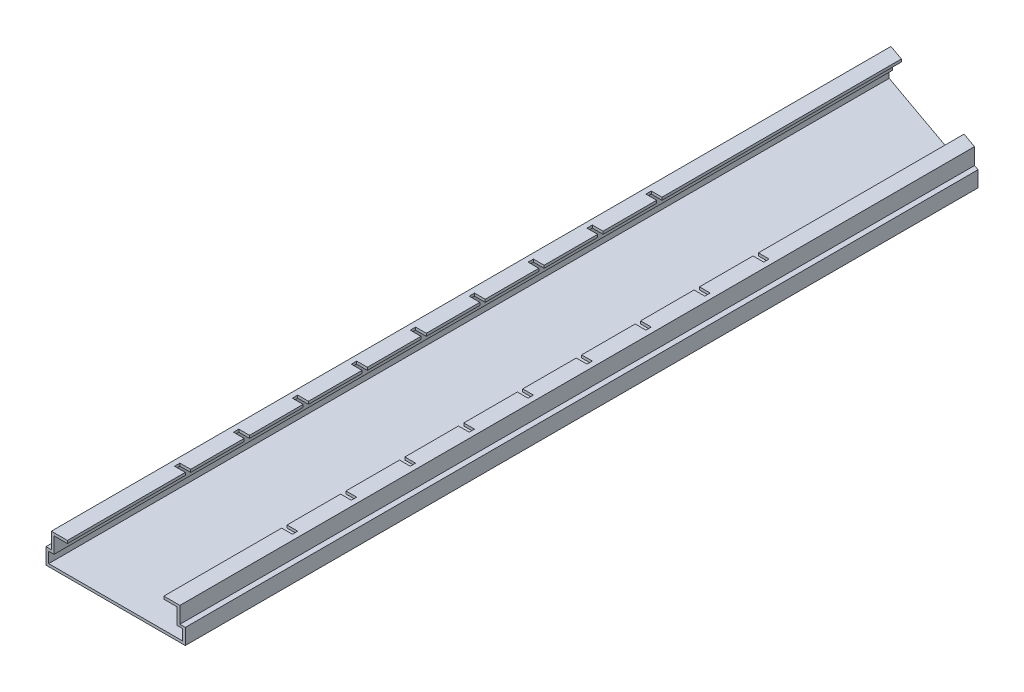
SolidWorks part; units mm, degrees
ref_plane "Plan de face" through (0, 0, 0) normal (0, 0, 1) x (1, 0, 0)
ref_plane "Plan de dessus" through (0, 0, 0) normal (0, 1, 0) x (1, 0, 0)
ref_plane "Plan de droite" through (0, 0, 0) normal (1, 0, 0) x (0, 0, -1)
sketch "Esquisse1" plane through (0, 0, 0) normal (0, 1, 0) x (1, 0, 0)
  line L0 (-13, 145) -> (-13, 157.1)
  line L1 (-13, 0) -> (13, 0)
  line L2 (-13, 0) -> (-13, 145)
  line L3 (-13, 145) -> (13, 145)
  line L4 (13, 0) -> (13, 145)
  line L5 (-13, 157.1) -> (13, 148)
  line L6 (13, 148) -> (13, 145)
  dimension "D1" = 26
  dimension "D2" = 145
  dimension "D3" = 3
  dimension "D4" = 12.1
extrude "Boss.-Extru.1" add sketch "Esquisse1" along normal blind 0.5
sketch "Esquisse3" plane through (0, 0, 0) normal (0, 0, 1) x (1, 0, 0)
  line L0 (-12, 6) -> (-12, 3)
  line L1 (-12, 6) -> (12, 6)
  line L2 (12, 6) -> (12, 2.9394)
  line L3 (-12, 3) -> (-13, 3)
  line L4 (-13, 0) -> (13, 0)
  line L5 (13, 0) -> (13, 0.5)
  line L6 (-13, 0) -> (13, 0)
  line L7 (-13, 0.5) -> (-13, 0)
  line L8 (13, 0.5) -> (-13, 0.5)
  line L9 (13, 0) -> (13, 0.5)
  line L10 (13, 0.5) -> (-13, 0.5)
  line L11 (-13, 0.5) -> (-13, 0)
  line L12 (-13, 3) -> (-13, 0.5)
  line L13 (12, 2.9394) -> (13, 2.9394)
  line L14 (13, 2.9394) -> (13, 0.5)
  line L15 (-9, 6) -> (-9, 5.5)
  line L16 (-9, 5.5) -> (-11.5, 5.5)
  line L17 (-11.5, 5.5) -> (-11.5, 2.5)
  line L18 (-11.5, 2.5) -> (-12.5, 2.5)
  line L19 (-12.5, 2.5) -> (-12.5, 0.5)
  line L20 (11.5, 2.5) -> (12.5, 2.5)
  line L21 (0, 0) -> (0, 9.4792) construction
  line L22 (12.5, 2.5) -> (12.5, 0.5)
  line L23 (13, 3) -> (13, 0.5)
  line L24 (12, 3) -> (13, 3)
  line L25 (11.5, 5.5) -> (11.5, 2.5)
  line L26 (12, 6) -> (12, 3)
  line L27 (9, 6) -> (9, 5.5)
  line L28 (9, 5.5) -> (11.5, 5.5)
  point P6 (0, 6)
  dimension "D2" = 24
  dimension "D3" = 5.5
  dimension "D4" = 0.5
  dimension "D5" = 0.5
  dimension "D6" = 0.5
  dimension "D7" = 0.5
  dimension "D10" = 3
  dimension "D1" = 0
extrude "Boss.-Extru.2" add sketch "Esquisse3" against normal up to surface (149.4 mm away) contours L27 L28 L25 L20 L22 L14 L13 L2 L1 M36
sketch "Esquisse5" plane through (0, 0, 0) normal (0, 0, 1) x (1, 0, 0)
  line L0 (-12, 6) -> (-12, 3)
  line L1 (-12, 6) -> (12, 6)
  line L2 (12, 6) -> (12, 2.9394)
  line L3 (-12, 3) -> (-13, 3)
  line L6 (-13, 0) -> (13, 0)
  line L9 (13, 0) -> (13, 0.5)
  line L10 (13, 0.5) -> (-13, 0.5)
  line L11 (-13, 0.5) -> (-13, 0)
  line L12 (-13, 3) -> (-13, 0.5)
  line L13 (12, 2.9394) -> (13, 2.9394)
  line L14 (13, 2.9394) -> (13, 0.5)
  line L15 (-9, 6) -> (-9, 5.5)
  line L16 (-9, 5.5) -> (-11.5, 5.5)
  line L17 (-11.5, 5.5) -> (-11.5, 2.5)
  line L18 (-11.5, 2.5) -> (-12.5, 2.5)
  line L19 (-12.5, 2.5) -> (-12.5, 0.5)
  line L20 (11.5, 2.5) -> (12.5, 2.5)
  line L21 (0, 0) -> (0, 9.4792) construction
  line L22 (12.5, 2.5) -> (12.5, 0.5)
  line L23 (13, 3) -> (13, 0.5)
  line L24 (12, 3) -> (13, 3)
  line L25 (11.5, 5.5) -> (11.5, 2.5)
  line L26 (12, 6) -> (12, 3)
  line L27 (9, 6) -> (9, 5.5)
  line L28 (9, 5.5) -> (11.5, 5.5)
  point P6 (0, 6)
  dimension "D2" = 24
  dimension "D3" = 5.5
  dimension "D4" = 0.5
  dimension "D5" = 0.5
  dimension "D6" = 0.5
  dimension "D7" = 0.5
  dimension "D10" = 3
extrude "Boss.-Extru.3" add sketch "Esquisse5" against normal up to surface (156.925 mm away) contours L19 L18 L17 L16 L15 L1 L0 L3 L12 L10
sketch "Esquisse4" plane through (0, 6, 0) normal (0, 1, 0) x (1, 0, 0)
  line L1 (-9, 33) -> (-11, 33)
  line L2 (-9, 33) -> (-9, 34)
  line L3 (-9, 34) -> (-11, 34)
  line L4 (-11, 33) -> (-11, 34)
  line L5 (-9, 44) -> (-11, 44)
  line L6 (-9, 44) -> (-9, 45)
  line L7 (-9, 45) -> (-11, 45)
  line L15 (-9, 155.7) -> (-12, 156.75)
  line L16 (-12, 0) -> (-9, 0)
  line L18 (-9, 22) -> (-11, 22)
  line L20 (-12, 156.75) -> (-12, 0)
  line L21 (-11, 22) -> (-11, 23)
  line L22 (-9, 22) -> (-9, 23)
  line L23 (-9, 23) -> (-11, 23)
  line L24 (-11, 0) -> (-11, 152.3383) construction
  line L25 (-12, 0) -> (-9, 0)
  line L26 (-11, 44) -> (-11, 45)
  line L27 (-11, 121) -> (-9, 121)
  line L28 (-9, 0) -> (-9, 155.7)
  line L29 (-9, 155.7) -> (-12, 156.75)
  line L31 (-9, 56) -> (-11, 56)
  line L32 (-9, 56) -> (-9, 55)
  line L33 (-9, 55) -> (-11, 55)
  line L34 (-11, 56) -> (-11, 55)
  line L35 (-11, 66) -> (-9, 66)
  line L36 (-11, 66) -> (-11, 67)
  line L37 (-11, 67) -> (-9, 67)
  line L38 (-9, 66) -> (-9, 67)
  line L39 (-9, 89) -> (-11, 89)
  line L40 (-9, 89) -> (-9, 88)
  line L41 (-9, 88) -> (-11, 88)
  line L42 (-11, 89) -> (-11, 88)
  line L43 (-9, 78) -> (-11, 78)
  line L44 (-9, 78) -> (-9, 77)
  line L45 (-9, 77) -> (-11, 77)
  line L46 (-11, 78) -> (-11, 77)
  line L47 (-9, 100) -> (-11, 100)
  line L48 (-9, 100) -> (-9, 99)
  line L49 (-9, 99) -> (-11, 99)
  line L50 (-11, 100) -> (-11, 99)
  line L51 (-9, 111) -> (-11, 111)
  line L52 (-9, 111) -> (-9, 110)
  line L53 (-9, 110) -> (-11, 110)
  line L54 (-11, 111) -> (-11, 110)
  line L55 (-12, 156.75) -> (-12, 0)
  line L56 (-12, 0) -> (-9, 0)
  line L57 (-9, 0) -> (-9, 155.7)
  dimension "D3" = 33
  dimension "D4" = 1
  dimension "D5" = 1
  dimension "D6" = 10
  dimension "D7" = 1
  dimension "D8" = 1
  dimension "D9" = 1
  dimension "D10" = 1
  dimension "D11" = 1
  dimension "D12" = 1
  dimension "D13" = 10
  dimension "D14" = 10
  dimension "D15" = 10
  dimension "D16" = 10
  dimension "D17" = 10
  dimension "D18" = 10
  dimension "D19" = 10
  dimension "D20" = 10
  dimension "D21" = 1
  dimension "D23" = 1
  dimension "D22" = 0
extrude "Enlèv. mat.-Extru.1" cut sketch "Esquisse4" against normal up to next
mirror "Symétrie1" about plane through (0, 0, 0) normal (1, 0, 0) of "Enlèv. mat.-Extru.1"
equation "\"D6@Esquisse3\"= \"D4@Esquisse3\""
equation "\"D7@Esquisse3\"=\"D4@Esquisse3\""
equation "\"D5@Esquisse3\"=\"D4@Esquisse3\""
equation "\"D5@Esquisse4\"=\"D4@Esquisse4\""
equation "\"D7@Esquisse4\"=\"D4@Esquisse4\""
equation "\"D8@Esquisse4\"= \"D4@Esquisse4\""
equation "\"D9@Esquisse4\"=\"D4@Esquisse4\""
equation "\"D10@Esquisse4\"=\"D4@Esquisse4\""
equation "\"D11@Esquisse4\"=\"D4@Esquisse4\""
equation "\"D12@Esquisse4\"=\"D4@Esquisse4\""
equation "\"D14@Esquisse4\"=\"D13@Esquisse4\""
equation "\"D15@Esquisse4\"=\"D13@Esquisse4\""
equation "\"D16@Esquisse4\"=\"D13@Esquisse4\""
equation "\"D17@Esquisse4\"=\"D13@Esquisse4\""
equation "\"D19@Esquisse4\"=\"D13@Esquisse4\""
equation "\"D18@Esquisse4\"=\"D13@Esquisse4\""
